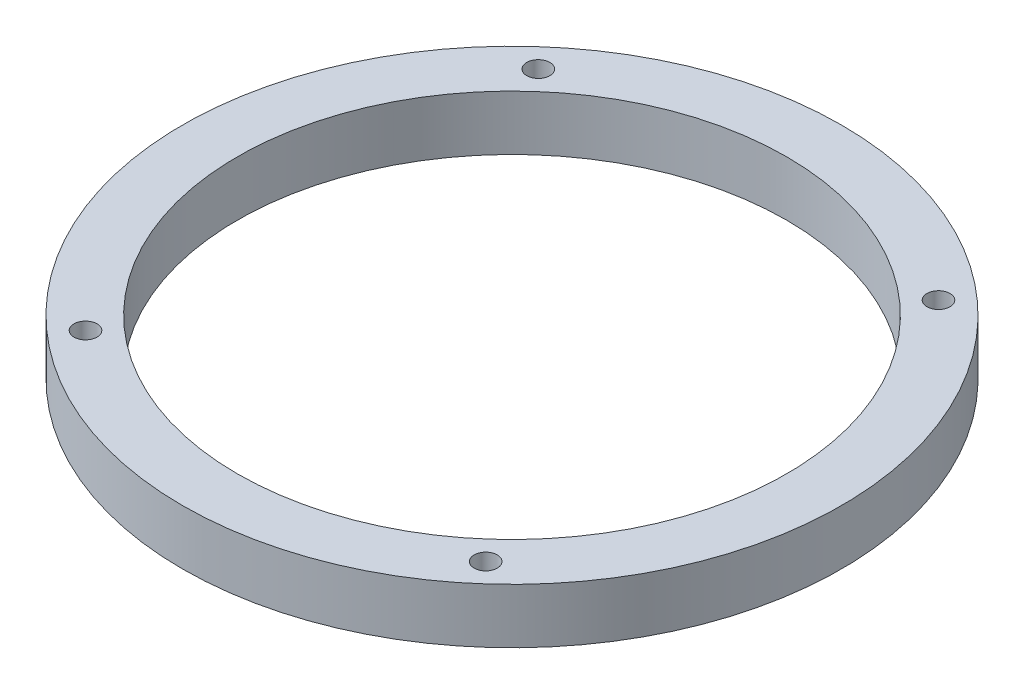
SolidWorks part; units mm, degrees
ref_plane "Front Plane" through (0, 0, 0) normal (0, 0, 1) x (1, 0, 0)
ref_plane "Top Plane" through (0, 0, 0) normal (0, 1, 0) x (1, 0, 0)
ref_plane "Right Plane" through (0, 0, 0) normal (1, 0, 0) x (0, 0, -1)
sketch "Sketch1" plane through (0, 0, 0) normal (0, 1, 0) x (1, 0, 0)
  line L0 (0, 0) -> (0, 60.0569) construction
  line L1 (0, 0) -> (0, -60.0569) construction
  line L2 (0, 0) -> (60.0569, 0) construction
  line L3 (0, 0) -> (-60.0569, 0) construction
  line L4 (0, 0) -> (-39.7723, 45) construction
  line L5 (0, 0) -> (39.7723, 45) construction
  line L6 (0, 0) -> (-39.7723, -45) construction
  line L7 (0, 0) -> (39.7723, -45) construction
  line L8 (-36.4297, 41.218) -> (36.4297, 41.218) construction
  line L9 (36.4297, 41.218) -> (36.4297, -41.218) construction
  line L10 (36.4297, -41.218) -> (-36.4297, -41.218) construction
  circle A0 centre (0, 0) radius 60
  circle A1 centre (0, 0) radius 50
  circle A9 centre (-36.4297, 41.218) radius 2.1
  circle A10 centre (36.4297, 41.218) radius 2.1
  circle A11 centre (-36.4297, -41.218) radius 2.1
  circle A12 centre (36.4297, -41.218) radius 2.1
  dimension "D1" = 45
extrude "Boss-Extrude1" add sketch "Sketch1" along normal blind 10
